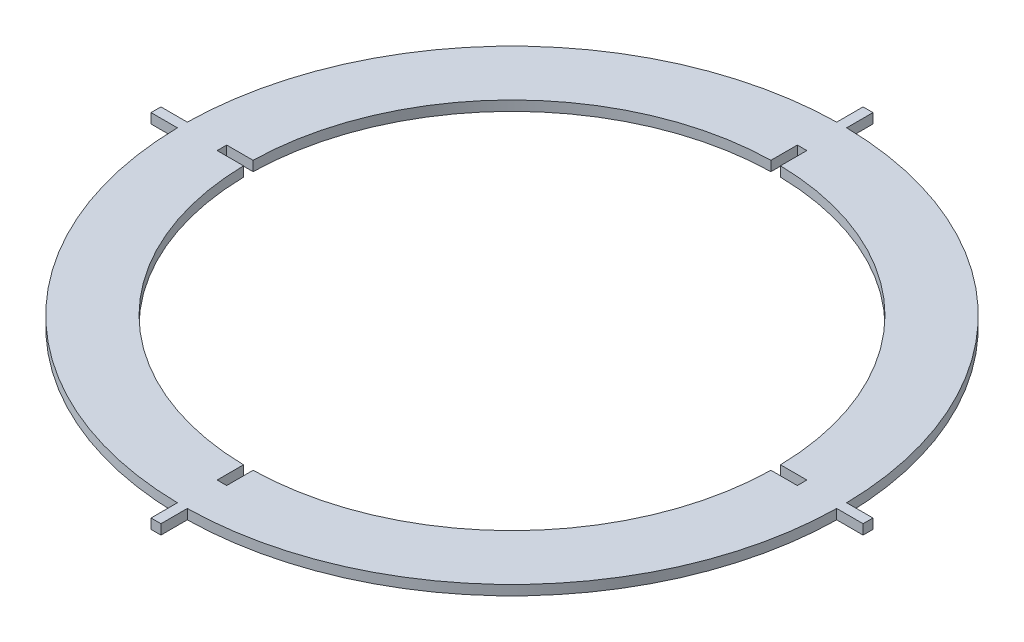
SolidWorks part; units mm, degrees
ref_plane "Front Plane" through (0, 0, 0) normal (0, 0, 1) x (1, 0, 0)
ref_plane "Top Plane" through (0, 0, 0) normal (0, 1, 0) x (1, 0, 0)
ref_plane "Right Plane" through (0, 0, 0) normal (1, 0, 0) x (0, 0, -1)
sketch "Sketch1" plane through (0, 0, 0) normal (0, 1, 0) x (1, 0, 0)
  line L0 (0, 0) -> (-29.8607, 0) construction
  line L1 (2.3553, 0) -> (0, 0) construction
  line L2 (0, 0) -> (0, -23.9022) construction
  line L3 (1.45, 87.9869) -> (1.45, 79.9869)
  line L4 (-147.992, 1.5) -> (-139.992, 1.5)
  line L5 (-147.992, 1.5) -> (-147.992, -1.5)
  line L6 (-147.992, -1.5) -> (-139.992, -1.5)
  line L7 (-1.45, 87.9869) -> (-1.45, 79.9869)
  line L8 (-127.9906, -1.5) -> (-119.9906, -1.5)
  line L9 (-127.9906, -1.5) -> (-127.9906, 1.5)
  line L10 (-127.9906, 1.5) -> (-119.9906, 1.5)
  line L11 (-1.45, 87.9869) -> (1.45, 87.9869)
  line L12 (-107.9887, -1.5) -> (-99.9887, -1.5)
  line L13 (-107.9887, -1.5) -> (-107.9887, 1.5)
  line L14 (-107.9887, 1.5) -> (-99.9887, 1.5)
  line L15 (-1.5, 107.9887) -> (-1.5, 99.9887)
  line L16 (-87.9869, -1.45) -> (-79.9869, -1.45)
  line L17 (-87.9869, -1.45) -> (-87.9869, 1.45)
  line L18 (-87.9869, 1.45) -> (-79.9869, 1.45)
  line L19 (1.5, 107.9887) -> (1.5, 99.9887)
  line L20 (-1.5, 107.9887) -> (1.5, 107.9887)
  line L21 (1.5, 127.9906) -> (1.5, 119.9906)
  line L22 (-1.5, 127.9906) -> (-1.5, 119.9906)
  line L23 (-1.5, 127.9906) -> (1.5, 127.9906)
  line L24 (1.5, 147.992) -> (1.5, 139.992)
  line L25 (-1.5, 147.992) -> (-1.5, 139.992)
  line L26 (87.9869, -1.45) -> (79.9869, -1.45)
  line L27 (87.9869, 1.45) -> (79.9869, 1.45)
  line L28 (87.9869, 1.45) -> (87.9869, -1.45)
  line L29 (107.9887, 1.5) -> (99.9887, 1.5)
  line L30 (107.9887, -1.5) -> (99.9887, -1.5)
  line L31 (107.9887, 1.5) -> (107.9887, -1.5)
  line L32 (127.9906, -1.5) -> (119.9906, -1.5)
  line L33 (127.9906, 1.5) -> (119.9906, 1.5)
  line L34 (127.9906, 1.5) -> (127.9906, -1.5)
  line L35 (147.992, -1.5) -> (139.992, -1.5)
  line L36 (147.992, 1.5) -> (139.992, 1.5)
  line L37 (-1.45, -87.9869) -> (-1.45, -79.9869)
  line L38 (1.45, -87.9869) -> (1.45, -79.9869)
  line L39 (1.45, -87.9869) -> (-1.45, -87.9869)
  line L40 (1.5, -107.9887) -> (1.5, -99.9887)
  line L41 (-1.5, -107.9887) -> (-1.5, -99.9887)
  line L42 (1.5, -107.9887) -> (-1.5, -107.9887)
  line L43 (-1.5, -127.9906) -> (-1.5, -119.9906)
  line L44 (1.5, -127.9906) -> (1.5, -119.9906)
  line L45 (1.5, -127.9906) -> (-1.5, -127.9906)
  line L46 (-1.5, -147.992) -> (-1.5, -139.992)
  line L47 (1.5, -147.992) -> (1.5, -139.992)
  line L48 (1.45, 87.9869) -> (1.45, 79.9869)
  line L49 (-1.45, 87.9869) -> (-1.45, 79.9869)
  line L50 (-1.45, 87.9869) -> (1.45, 87.9869)
  line L51 (-1.5, 107.9887) -> (-1.5, 99.9887)
  line L52 (1.5, 107.9887) -> (1.5, 99.9887)
  line L53 (-1.5, 107.9887) -> (1.5, 107.9887)
  line L54 (1.5, 127.9906) -> (1.5, 119.9906)
  line L55 (-1.5, 127.9906) -> (-1.5, 119.9906)
  line L56 (-1.5, 127.9906) -> (1.5, 127.9906)
  line L57 (1.5, 147.992) -> (1.5, 139.992)
  line L58 (-1.5, 147.992) -> (-1.5, 139.992)
  line L59 (1.5, 147.992) -> (-1.5, 147.992)
  line L60 (87.9869, -1.45) -> (79.9869, -1.45)
  line L61 (87.9869, 1.45) -> (79.9869, 1.45)
  line L62 (87.9869, 1.45) -> (87.9869, -1.45)
  line L63 (107.9887, 1.5) -> (99.9887, 1.5)
  line L64 (107.9887, -1.5) -> (99.9887, -1.5)
  line L65 (107.9887, 1.5) -> (107.9887, -1.5)
  line L66 (127.9906, -1.5) -> (119.9906, -1.5)
  line L67 (127.9906, 1.5) -> (119.9906, 1.5)
  line L68 (127.9906, 1.5) -> (127.9906, -1.5)
  line L69 (147.992, -1.5) -> (139.992, -1.5)
  line L70 (147.992, 1.5) -> (139.992, 1.5)
  line L71 (147.992, -1.5) -> (147.992, 1.5)
  line L72 (-1.45, -87.9869) -> (-1.45, -79.9869)
  line L73 (1.45, -87.9869) -> (1.45, -79.9869)
  line L74 (1.45, -87.9869) -> (-1.45, -87.9869)
  line L75 (1.5, -107.9887) -> (1.5, -99.9887)
  line L76 (-1.5, -107.9887) -> (-1.5, -99.9887)
  line L77 (1.5, -107.9887) -> (-1.5, -107.9887)
  line L78 (-1.5, -127.9906) -> (-1.5, -119.9906)
  line L79 (1.5, -127.9906) -> (1.5, -119.9906)
  line L80 (1.5, -127.9906) -> (-1.5, -127.9906)
  line L81 (-1.5, -147.992) -> (-1.5, -139.992)
  line L82 (1.5, -147.992) -> (1.5, -139.992)
  line L83 (-1.5, -147.992) -> (1.5, -147.992)
  arc A0 (-79.9869, -1.45) -> (-1.45, -79.9869) centre (0, 0) ccw
  arc A1 (-99.9887, -1.5) -> (-1.5, -99.9887) centre (0, 0) ccw
  arc A2 (-119.9906, -1.5) -> (-1.5, -119.9906) centre (0, 0) ccw
  arc A3 (-139.992, -1.5) -> (-1.5, -139.992) centre (0, 0) ccw
  arc A4 (1.5, -139.992) -> (139.992, -1.5) centre (0, 0) ccw
  arc A5 (1.5, -119.9906) -> (119.9906, -1.5) centre (0, 0) ccw
  arc A6 (1.45, -79.9869) -> (79.9869, -1.45) centre (0, 0) ccw
  arc A7 (1.5, -99.9887) -> (99.9887, -1.5) centre (0, 0) ccw
  arc A8 (-1.45, 79.9869) -> (-79.9869, 1.45) centre (0, 0) ccw
  arc A9 (-1.5, 99.9887) -> (-99.9887, 1.5) centre (0, 0) ccw
  arc A10 (-1.5, 119.9906) -> (-119.9906, 1.5) centre (0, 0) ccw
  arc A11 (-1.5, 139.992) -> (-139.992, 1.5) centre (0, 0) ccw
  arc A12 (79.9869, 1.45) -> (1.45, 79.9869) centre (0, 0) ccw
  arc A13 (99.9887, 1.5) -> (1.5, 99.9887) centre (0, 0) ccw
  arc A14 (119.9906, 1.5) -> (1.5, 119.9906) centre (0, 0) ccw
  arc A15 (139.992, 1.5) -> (1.5, 139.992) centre (0, 0) ccw
  point P71 (0, 0)
  point P97 (0, 0)
  point P146 (0, 0)
  dimension "D1" = 280
  dimension "D4" = 160
  dimension "D5" = 3
  dimension "D6" = 8
  dimension "D3" = 200
  dimension "D2" = 240
  dimension "D8" = 4
  dimension "D7" = 4
  dimension "D9" = 2.9
extrude "Boss-Extrude1" add sketch "Sketch1" along normal blind 3 contours L29 A13 L19 L20 L15 A9 L14 L13 L12 A1 L41 L42 L40 A7 L30 L31 A12 L27 L28 L26 A6 L38 L39 L37 A0 L16 L17 L18 A8 L7 L11 L3
